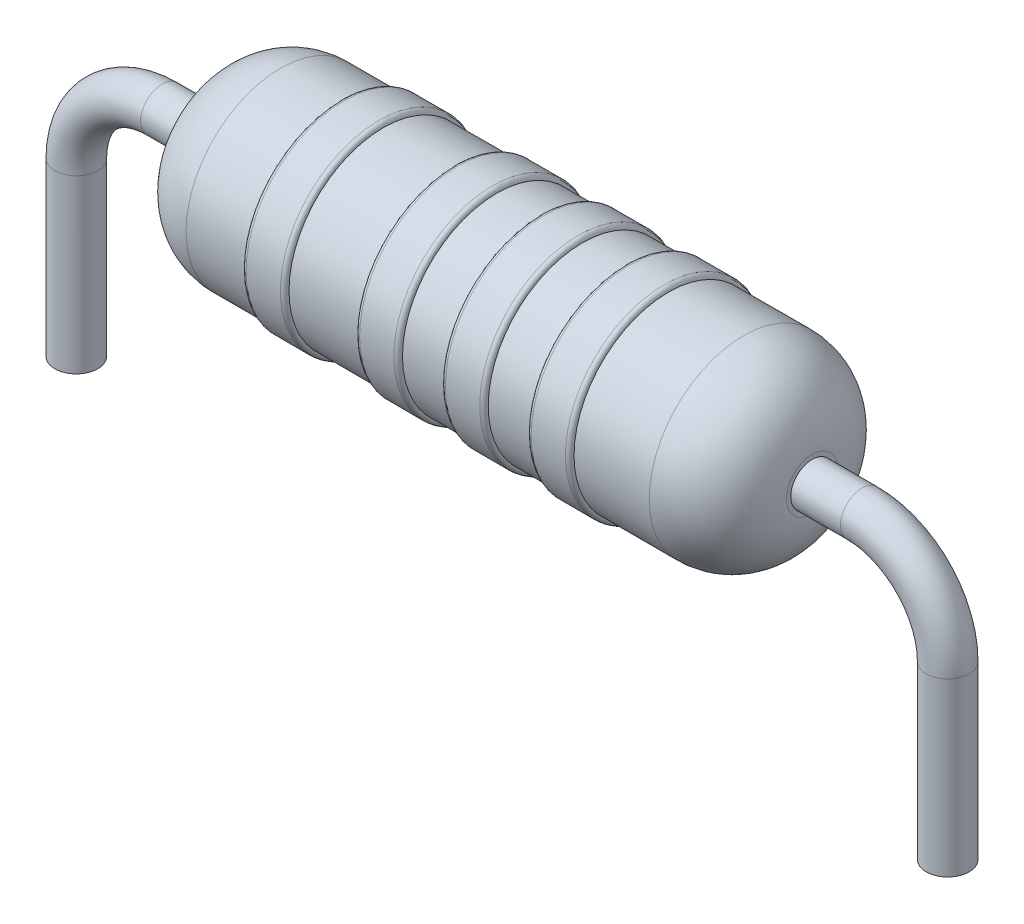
SolidWorks part; units mm, degrees
ref_plane "Face" through (0, 0, 0) normal (0, 0, 1) x (1, 0, 0)
ref_plane "Dessus" through (0, 0, 0) normal (0, 1, 0) x (1, 0, 0)
ref_plane "Droite" through (0, 0, 0) normal (1, 0, 0) x (0, 0, -1)
sketch "Esquisse1" plane through (0, 0, 0) normal (0, 0, 1) x (1, 0, 0)
  line L0 (-54.2687, 0) -> (62.1733, 0) construction
  line L1 (-48.4922, 1.1) -> (45.7559, 1.1) construction
  line L2 (-3.5, -1.6411) -> (-3.5, 4.3175) construction
  line L3 (0, -1.0268) -> (0, 4.1947) construction
  line L4 (3.5, 3.6009) -> (3.5, -1.9687) construction
  line L5 (-3.5, 0) -> (-3.5, 0.3)
  line L6 (-2.7, 1.1) -> (2.7, 1.1)
  line L7 (3.5, 0.3) -> (3.5, 0)
  line L8 (3.5, 0) -> (-3.5, 0)
  arc A0 (-2.7, 1.1) -> (-3.5, 0.3) centre (-2.7, 0.3) ccw
  arc A1 (3.5, 0.3) -> (2.7, 1.1) centre (2.7, 0.3) ccw
revolve "Base-Révolution" add sketch "Esquisse1" angle 360 about L0
sketch "Esquisse2" plane through (0, 0, 0) normal (0, 0, 1) x (1, 0, 0)
  line L0 (-3.3896, 1.15) -> (3.161, 1.15) construction
  line L1 (-2, 1.3889) -> (-2, -0.1179) construction
  line L2 (-1.5, 1.4925) -> (-1.5, -0.2136) construction
  line L3 (4.3262, 0) -> (-3.8651, 0) construction
  line L4 (1.323, 0) -> (1.823, 0)
  line L5 (0.323, 0) -> (0.823, 0)
  line L6 (-0.677, 1.15) -> (-0.677, 0)
  line L7 (0.323, 1.15) -> (0.323, 0)
  line L8 (1.323, 1.15) -> (1.323, 0)
  line L9 (-0.177, 1.15) -> (-0.177, 0)
  line L10 (0.823, 1.15) -> (0.823, 0)
  line L11 (1.823, 1.15) -> (1.823, 0)
  line L12 (-0.677, 0) -> (-0.177, 0)
  line L13 (-0.677, 1.15) -> (-0.177, 1.15)
  line L14 (0.323, 1.15) -> (0.823, 1.15)
  line L15 (1.323, 1.15) -> (1.823, 1.15)
  line L16 (-2, 1.15) -> (-1.5, 1.15)
  line L17 (-1.5, 1.15) -> (-1.5, 0)
  line L18 (-1.5, 0) -> (-2, 0)
  line L19 (-2, 0) -> (-2, 1.15)
revolve "Boss.-Révol.1" add sketch "Esquisse2" angle 360 about L3
fillet "Congé1" radius 0.05 8 edges at (-0.177, 0, -1.15) (-0.677, 0, -1.15) (0.823, 0, -1.15) (0.323, 0, -1.15) (1.823, 0, -1.15) (1.323, 0, -1.15) (-1.5, 0, -1.15) (-2, 0, -1.15)
sketch "Esquisse3" plane through (-3.5, 0, 0) normal (-1, 0, 0) x (0, 0, 1)
  circle A0 centre (0, 0) radius 0.25
sketch "Esquisse4" plane through (0, 0, 0) normal (0, 0, 1) x (1, 0, 0)
  line L0 (-3.1075, 0) -> (-5.8186, 0) construction
  line L1 (0, -2.524) -> (0, 3.2043) construction
  line L2 (-5.9326, -3) -> (3.6667, -3) construction
  line L3 (-5.08, 1.6795) -> (-5.08, -3.4934) construction
  line L4 (-3.08, 0) -> (-4.08, 0)
  line L5 (-5.08, -1) -> (-5.08, -3)
  arc A0 (-4.08, 0) -> (-5.08, -1) centre (-4.08, -1) ccw
  dimension "D1" = 3
  dimension "D2" = 5.08
sweep "Balayage1" add profiles "Esquisse3" path "Esquisse4"
ref_plane "Plan1" through (0, 0, 0) normal (1, 0, 0) x (0, 0, -1)
mirror "Symétrie1" about plane through (0, 0, 0) normal (1, 0, 0) of "Balayage1"
